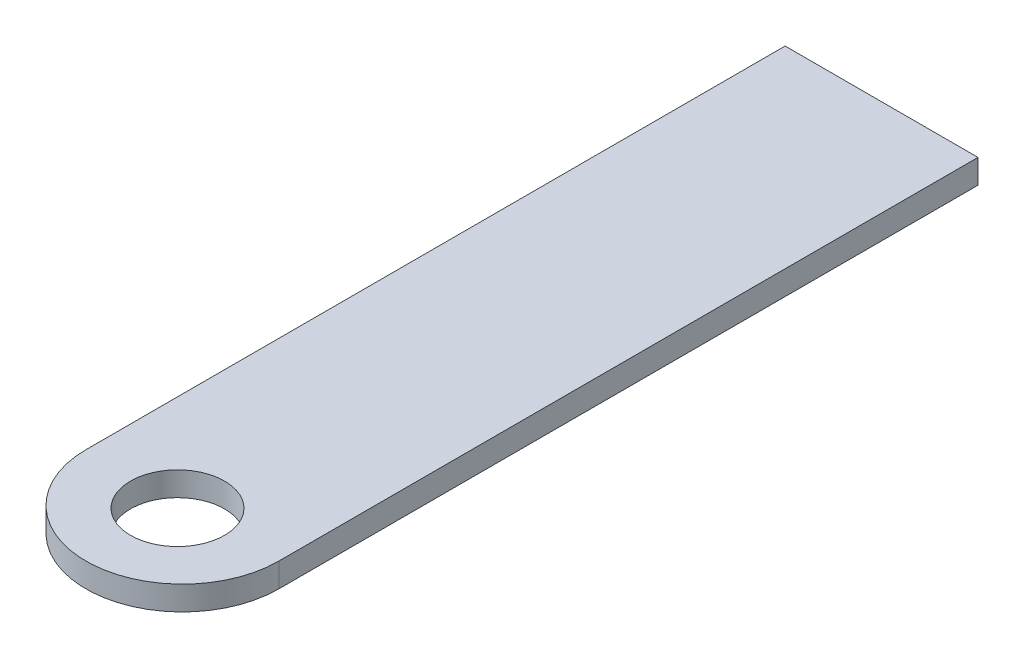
SolidWorks part; units mm, degrees
ref_plane "Piano frontale" through (0, 0, 0) normal (0, 0, 1) x (1, 0, 0)
ref_plane "Piano superiore" through (0, 0, 0) normal (0, 1, 0) x (1, 0, 0)
ref_plane "Piano destro" through (0, 0, 0) normal (1, 0, 0) x (0, 0, -1)
sketch "Schizzo1" plane through (0, 0, 0) normal (0, 1, 0) x (1, 0, 0)
  line L0 (0, -82.5) -> (0, -63.5) construction
  line L5 (-20, 82.5) -> (20, 82.5)
  line L6 (-20, 82.5) -> (-20, -62.5)
  line L8 (20, 82.5) -> (20, -62.5)
  line L11 (0, -82.5) -> (0, -62.5) construction
  circle A2 centre (0, -63.5) radius 9.75
  arc A3 (-20, -62.5) -> (20, -62.5) centre (0, -62.5) ccw
  point P0 (0, 0)
  dimension "D3" = 19
  dimension "D4" = 19.5
  dimension "D5" = 20
  dimension "D6" = 20
  dimension "D1" = 145
  dimension "D2" = 40
  dimension "D7" = 165
base flange "Base-Flangia1" sketch "Schizzo1" thickness 5 reverse thickness direction no parameters "D1"=1.5
sketch "Linee di piegatura1" [suppressed] plane through (0, 0, 0) normal (0, 1, 0) x (1, 0, 0)
sketch "Casella di contorno1" [suppressed] plane through (0, 0, 0) normal (0, 1, 0) x (1, 0, 0)
sheet metal parameters "Lamiera1" thickness 5 parameters "D1"=1.5
flat pattern "Ripetizione piatta1"
sketch "Linee di piegatura2" plane through (0, 0, 0) normal (0, 1, 0) x (1, 0, 0)
sketch3d "Casella di contorno2" [suppressed]
  line L0 (-20, 145, 0) -> (-20, -20, 0) construction
  line L1 (20, 145, 0) -> (20, -20, 0) construction
  line L2 (-20, 145, 0) -> (20, 145, 0) construction
  line L3 (-20, -20, 0) -> (20, -20, 0) construction
